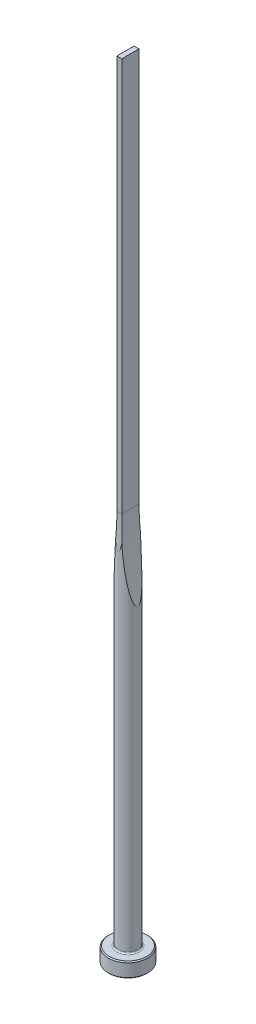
SolidWorks part; units mm, degrees
ref_plane "Front Plane" through (0, 0, 0) normal (0, 0, 1) x (1, 0, 0)
ref_plane "Top Plane" through (0, 0, 0) normal (0, 1, 0) x (1, 0, 0)
ref_plane "Right Plane" through (0, 0, 0) normal (1, 0, 0) x (0, 0, -1)
sketch "Sketch1" plane through (0, 0, 0) normal (0, 0, 1) x (1, 0, 0)
  line L0 (0, 0) -> (3.8, 0)
  line L1 (55, 0) -> (-55, 0) construction
  line L2 (4, 0.2) -> (4, 2.8)
  line L3 (3.8, 3) -> (2.3, 3)
  line L4 (2, 3.3) -> (2, 160)
  line L5 (0, 160) -> (2, 160)
  line L6 (4, 2.8) -> (3.8, 3)
  line L7 (3.8, 0) -> (4, 0.2)
  line L8 (0, 160) -> (0, 0)
  arc A0 (2, 3.3) -> (2.3, 3) centre (2.3, 3.3) ccw
  point P1 (4, 0)
  point P6 (4, 3)
  dimension "D4" = 0.3
  dimension "D1" = 2
  dimension "D2" = 4
  dimension "D3" = 3
  dimension "D5" = 160
revolve "Revolve1" add sketch "Sketch1" angle 360 about L8
sketch "Sketch2" plane through (0, 0, 0) normal (0, 0, 1) x (1, 0, 0)
  line L0 (0.5, 160) -> (0.5, 80)
  line L1 (2, 160) -> (-2, 160) construction
  line L2 (-0.5, 160) -> (-0.5, 80)
  line L3 (2, 160) -> (2, 63.6369)
  line L4 (-2, 160) -> (-2, 63.6369)
  line L5 (0, -4.4) -> (0, 4.4) construction
  line L6 (2, 160) -> (0.5, 160)
  line L8 (-0.5, 160) -> (-2, 160)
  arc A0 (0.5, 80) -> (2, 63.6369) centre (90.5, 80) ccw
  arc A1 (-0.5, 80) -> (-2, 63.6369) centre (-90.5, 80) cw
  dimension "D4" = 90
  dimension "D1" = 80
  dimension "D2" = 1
  dimension "D3" = 0.5
extrude "Cut-Extrude1" cut sketch "Sketch2" against normal mid plane 10
sketch "Sketch3" plane through (0, 0, 0) normal (1, 0, 0) x (0, 0, -1)
  line L0 (1.75, 160) -> (1.75, 80)
  line L1 (-1.9365, 160) -> (1.9365, 160) construction
  line L2 (-1.75, 160) -> (-1.75, 80)
  line L3 (2, 160) -> (2, 73.2965)
  line L4 (1.75, 160) -> (2, 160)
  line L5 (0, 4.4) -> (0, -4.4) construction
  line L6 (-2, 160) -> (-2, 73.2965)
  line L8 (-1.75, 160) -> (-2, 160)
  arc A0 (1.75, 80) -> (2, 73.2965) centre (91.75, 80) ccw
  arc A1 (-1.75, 80) -> (-2, 73.2965) centre (-91.75, 80) cw
  dimension "D2" = 90
  dimension "D1" = 80
  dimension "D3" = 3.5
  dimension "D4" = 1.75
extrude "Cut-Extrude2" cut sketch "Sketch3" against normal mid plane 10
